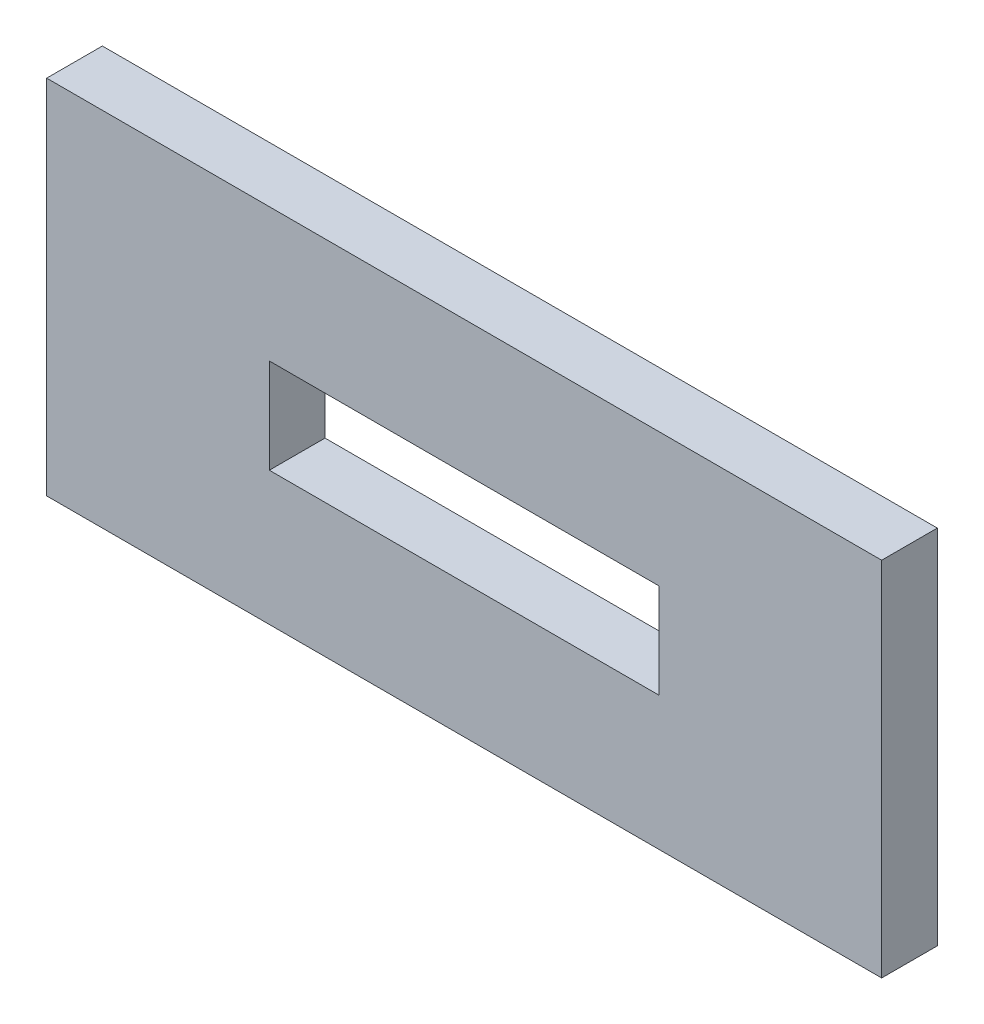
SolidWorks part; units mm, degrees
ref_plane "Ebene vorne" through (0, 0, 0) normal (0, 0, 1) x (1, 0, 0)
ref_plane "Ebene oben" through (0, 0, 0) normal (0, 1, 0) x (1, 0, 0)
ref_plane "Ebene rechts" through (0, 0, 0) normal (1, 0, 0) x (0, 0, -1)
sketch "Skizze1" plane through (0, 0, 0) normal (0, 1, 0) x (1, 0, 0)
  line L1 (0, 0) -> (-300, 0)
  line L2 (0, 0) -> (0, -20)
  line L3 (0, -20) -> (-300, -20)
  line L4 (-300, 0) -> (-300, -20)
  dimension "D1" = 300
  dimension "D2" = 20
extrude "Aufsatz-Linear austragen1" add sketch "Skizze1" along normal blind 130
sketch "Skizze2" plane through (0, 0, 20) normal (0, 0, 1) x (1, 0, 0)
  line L2 (-220, 48) -> (-80, 48)
  line L3 (-220, 48) -> (-220, 82)
  line L4 (-220, 82) -> (-80, 82)
  line L5 (-80, 48) -> (-80, 82)
  line L6 (-220, 48) -> (-80, 82) construction
  line L7 (-220, 82) -> (-80, 48) construction
  point P4 (-150, 65)
  dimension "D1" = 34
  dimension "D2" = 140
extrude "Schnitt-Linear austragen1" cut sketch "Skizze2" against normal blind 20
